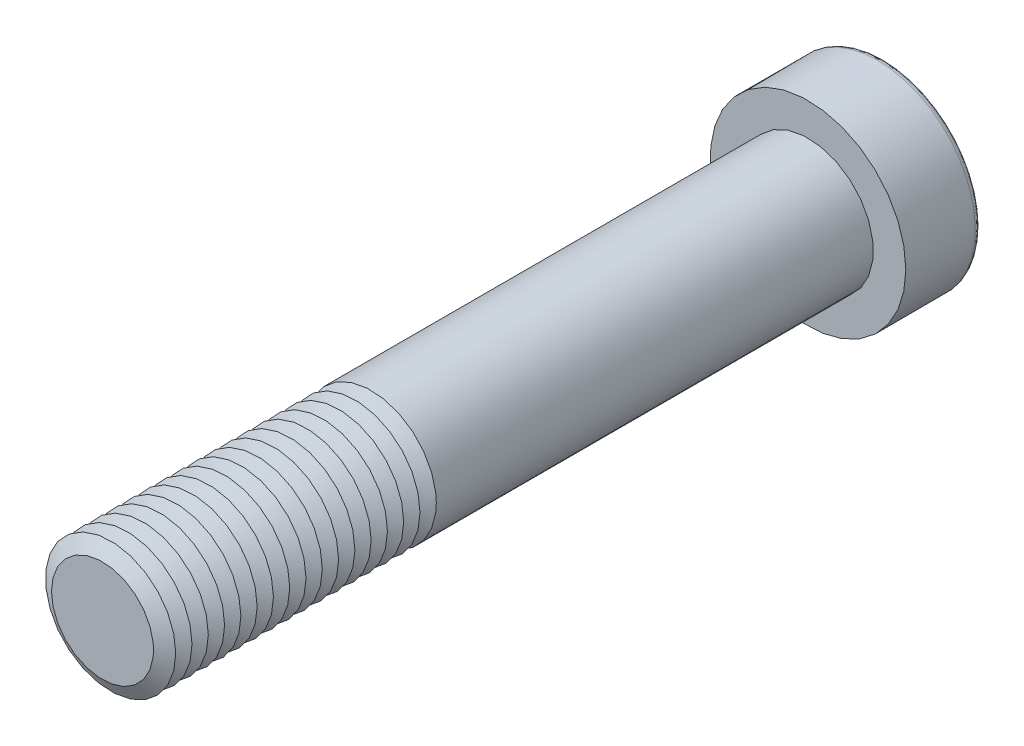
SolidWorks part; units mm, degrees
ref_plane "Front Plane" through (0, 0, 0) normal (0, 0, 1) x (1, 0, 0)
ref_plane "Top Plane" through (0, 0, 0) normal (0, 1, 0) x (1, 0, 0)
ref_plane "Right Plane" through (0, 0, 0) normal (1, 0, 0) x (0, 0, -1)
sketch "Sketch1" plane through (0, 0, 0) normal (0, 0, 1) x (1, 0, 0)
  circle A0 centre (0, 0) radius 12
  dimension "D1" = 24
extrude "Boss-Extrude1" add sketch "Sketch1" along normal blind 130
sketch "Sketch2" plane through (0, 0, 0) normal (0, 0, -1) x (-1, 0, 0)
  circle A0 centre (0, 0) radius 18
  dimension "D1" = 36
extrude "Boss-Extrude2" add sketch "Sketch2" along normal blind 14
sketch "Sketch3" plane through (0, 0, -14) normal (0, 0, -1) x (-1, 0, 0)
  line L1 (-5.4848, 9.5) -> (-10.9697, 0)
  line L2 (-10.9697, 0) -> (-5.4848, -9.5)
  line L3 (-5.4848, -9.5) -> (5.4848, -9.5)
  line L4 (5.4848, -9.5) -> (10.9697, 0)
  line L5 (10.9697, 0) -> (5.4848, 9.5)
  line L6 (5.4848, 9.5) -> (-5.4848, 9.5)
  circle A0 centre (0, 0) radius 9.5 construction
  dimension "D1" = 19
extrude "Cut-Extrude1" cut sketch "Sketch3" against normal blind 14.25
fillet "Fillet1" radius 1.2 1 edges at (-18, 0, -14)
sketch "Sketch4" plane through (0, 0, 0.25) normal (0, 0, -1) x (-1, 0, 0)
  line L0 (5.4848, -9.5) -> (10.9697, 0) construction
  circle A0 centre (0, 0) radius 9.5
extrude "Cut-Extrude2" cut sketch "Sketch4" against normal through all draft 60
sketch "Sketch5" plane through (0, 0, -14) normal (0, 0, -1) x (-1, 0, 0)
  circle A0 centre (0, 0) radius 10.9697
extrude "Cut-Extrude3" cut sketch "Sketch5" against normal through all draft 75
sketch "Sketch7" plane through (0, 0, 0) normal (1, 0, 0) x (0, 0, -1)
  line L25 (-130, 9.4019) -> (-128.5, 12)
  line L26 (-130, 12) -> (-130, -12) construction
  line L27 (-128.5, 12) -> (-131.5, 12)
  line L28 (-131.5, 12) -> (-130, 9.4019)
  line L29 (0, 12) -> (-130, 12) construction
  dimension "D1" = 3
revolve "Cut-Revolve1" cut sketch "Sketch7" angle 360 about axis through (0, 0, 130) along (0, 0, -1)
pattern_linear "LPattern1" count 17 spacing 3 along (0, 0, -1) of "Cut-Revolve1"
